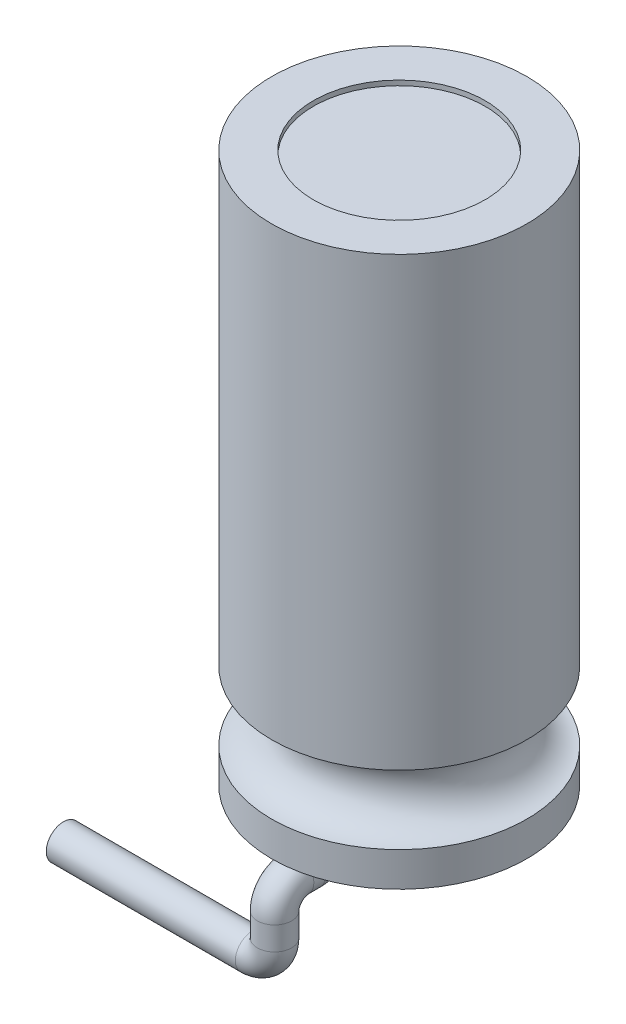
SolidWorks part; units mm, degrees
ref_plane "Face" through (0, 0, 0) normal (0, 0, 1) x (1, 0, 0)
ref_plane "Dessus" through (0, 0, 0) normal (0, 1, 0) x (1, 0, 0)
ref_plane "Droite" through (0, 0, 0) normal (1, 0, 0) x (0, 0, -1)
sketch "Esquisse1" plane through (0, 0, 0) normal (0, 0, 1) x (1, 0, 0)
  line L0 (0, 48.4017) -> (0, -33.7592) construction
  line L1 (0, 38.7164) -> (2.6, 38.7164)
  line L2 (2.6, 38.7164) -> (2.6, 29.6164)
  line L3 (2.6, 28.2164) -> (2.6, 27.5164)
  line L4 (2.6, 27.5164) -> (0, 27.5164)
  line L5 (0, 27.5164) -> (0, 38.7164)
  line L6 (9.8114, 29.7164) -> (-7.1309, 29.7164) construction
  line L7 (2.6, 25.0819) -> (2.6, 32.6721) construction
  line L8 (5.1241, 27.5164) -> (-5.6865, 27.5164) construction
  line L9 (5.1241, 29.0164) -> (-3.1767, 29.0164) construction
  arc A0 (2.6, 29.6164) -> (2.6, 28.2164) centre (2.6, 28.9164) ccw
  dimension "D4" = 0.7
  dimension "D1" = 11.2
  dimension "D2" = 2.6
  dimension "D3" = 1.5
revolve "Révolution1" add sketch "Esquisse1" angle 360 about L0
sketch "Esquisse2" plane through (0, 38.7164, 0) normal (0, 1, 0) x (-1, 0, 0)
  circle A0 centre (0, 0) radius 1.75
  dimension "D1" = 3.5
extrude "Enlèv. mat.-Extru.1" cut sketch "Esquisse2" against normal blind 0.1
sketch "Esquisse3" plane through (0, 27.5164, 0) normal (0, -1, 0) x (1, 0, 0)
  line L0 (4.0351, 0) -> (-4.283, 0) construction
  line L1 (0, 6.7464) -> (0, -6.9013) construction
  circle A0 centre (0, 1.4) radius 0.35
sketch "Esquisse4" plane through (0, 0, 0) normal (1, 0, 0) x (0, 0, -1)
  line L0 (-1.4, 24.8484) -> (-1.4, 29.3314) construction
  line L1 (-5.5325, 27.0164) -> (6.9013, 27.0164) construction
  line L2 (-2.54, 27.3439) -> (-2.54, 18.8472) construction
  line L3 (-8.7913, 27.5164) -> (10.5025, 27.5164) construction
  line L4 (0, 26.7733) -> (0, 22.2147) construction
  line L5 (-2.54, 26.1398) -> (-2.54, 26.5664)
  line L6 (-2.09, 27.0164) -> (-1.85, 27.0164)
  line L7 (-1.4, 27.4664) -> (-1.4, 27.5164)
  arc A0 (-2.54, 26.5664) -> (-2.09, 27.0164) centre (-2.09, 26.5664) cw
  arc A1 (-1.85, 27.0164) -> (-1.4, 27.4664) centre (-1.85, 27.4664) ccw
  point P16 (-2.54, 27.0164)
  point P19 (-1.4, 27.0164)
  dimension "D3" = 0.45
  dimension "D1" = 0.5
  dimension "D2" = 2.54
sweep "Balayage1" add profiles "Esquisse3" path "Esquisse4"
sketch "Esquisse7" plane through (0, 26.1398, 0) normal (0, -1, 0) x (1, 0, 0)
  circle A0 centre (0, 2.54) radius 0.35
ref_plane "Plan1" through (0, 0, 2.54) normal (0, 0, 1) x (1, 0, 0)
sketch "Esquisse8" plane through (0, 0, 2.54) normal (0, 0, 1) x (1, 0, 0)
  line L0 (0, 23.6206) -> (0, 26.967) construction
  line L1 (1.0448, 26.1398) -> (-2.4182, 26.1398) construction
  line L2 (1.0448, 25.6398) -> (-7.4345, 25.6398) construction
  line L3 (-2.6, 27.2288) -> (-2.6, 19.5303) construction
  line L4 (-4.3, 27.2288) -> (-4.3, 19.5303) construction
  line L5 (-4.3, 25.6398) -> (-0.45, 25.6398)
  line L6 (0, 26.0898) -> (0, 26.1398)
  arc A0 (-0.45, 25.6398) -> (0, 26.0898) centre (-0.45, 26.0898) ccw
  point P18 (0, 25.6398)
  dimension "D3" = 0.45
  dimension "D1" = 0.5
  dimension "D2" = 1.7
sweep "Balayage2" add profiles "Esquisse7" path "Esquisse8"
ref_plane "Plan2" through (0, 0, 0) normal (0, 0, 1) x (1, 0, 0)
mirror "Symétrie1" about plane through (0, 0, 0) normal (0, 0, 1) of "Balayage2", "Balayage1"
